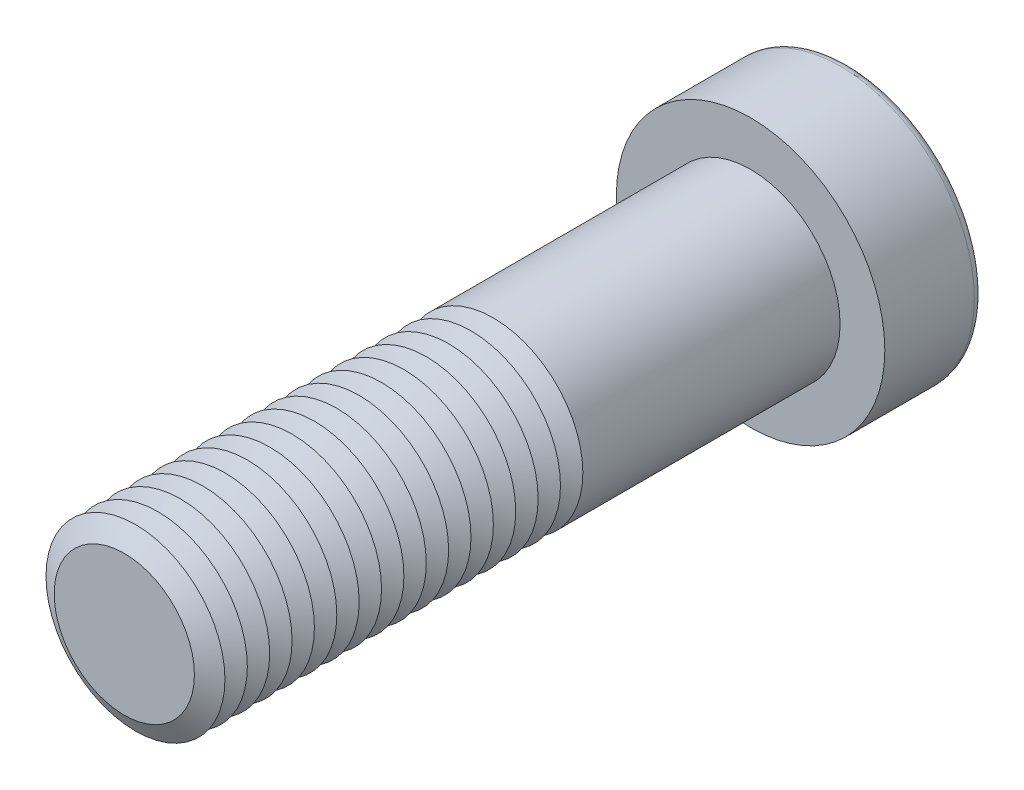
SolidWorks part; units mm, degrees
ref_plane "Front Plane" through (0, 0, 0) normal (0, 0, 1) x (1, 0, 0)
ref_plane "Top Plane" through (0, 0, 0) normal (0, 1, 0) x (1, 0, 0)
ref_plane "Right Plane" through (0, 0, 0) normal (1, 0, 0) x (0, 0, -1)
sketch "Sketch1" plane through (0, 0, 0) normal (0, 0, 1) x (1, 0, 0)
  circle A0 centre (0, 0) radius 10
  dimension "D1" = 20
extrude "Boss-Extrude1" add sketch "Sketch1" along normal blind 70
sketch "Sketch2" plane through (0, 0, 0) normal (0, 0, -1) x (-1, 0, 0)
  circle A0 centre (0, 0) radius 15
  dimension "D1" = 30
extrude "Boss-Extrude2" add sketch "Sketch2" along normal blind 11
sketch "Sketch3" plane through (0, 0, -11) normal (0, 0, -1) x (-1, 0, 0)
  line L1 (-4.0415, 7) -> (-8.0829, 0)
  line L2 (-8.0829, 0) -> (-4.0415, -7)
  line L3 (-4.0415, -7) -> (4.0415, -7)
  line L4 (4.0415, -7) -> (8.0829, 0)
  line L5 (8.0829, 0) -> (4.0415, 7)
  line L6 (4.0415, 7) -> (-4.0415, 7)
  circle A0 centre (0, 0) radius 7 construction
  dimension "D1" = 14
extrude "Cut-Extrude1" cut sketch "Sketch3" against normal blind 10.5
fillet "Fillet1" radius 1 1 edges at (-15, 0, -11)
sketch "Sketch4" plane through (0, 0, -0.5) normal (0, 0, -1) x (-1, 0, 0)
  line L0 (4.0415, -7) -> (8.0829, 0) construction
  circle A0 centre (0, 0) radius 7
extrude "Cut-Extrude2" cut sketch "Sketch4" against normal through all draft 60
sketch "Sketch5" plane through (0, 0, -11) normal (0, 0, -1) x (-1, 0, 0)
  circle A0 centre (0, 0) radius 8.0829
extrude "Cut-Extrude3" cut sketch "Sketch5" against normal through all draft 75
sketch "Sketch7" plane through (0, 0, 0) normal (1, 0, 0) x (0, 0, -1)
  line L25 (-70, 7.8349) -> (-68.75, 10)
  line L26 (-70, 10) -> (-70, -10) construction
  line L27 (-68.75, 10) -> (-71.25, 10)
  line L28 (-71.25, 10) -> (-70, 7.8349)
  line L29 (0, 10) -> (-70, 10) construction
  dimension "D1" = 2.5
revolve "Cut-Revolve1" cut sketch "Sketch7" angle 360 about axis through (0, 0, 70) along (0, 0, -1)
pattern_linear "LPattern1" count 17 spacing 2.5 along (0, 0, -1) of "Cut-Revolve1"
